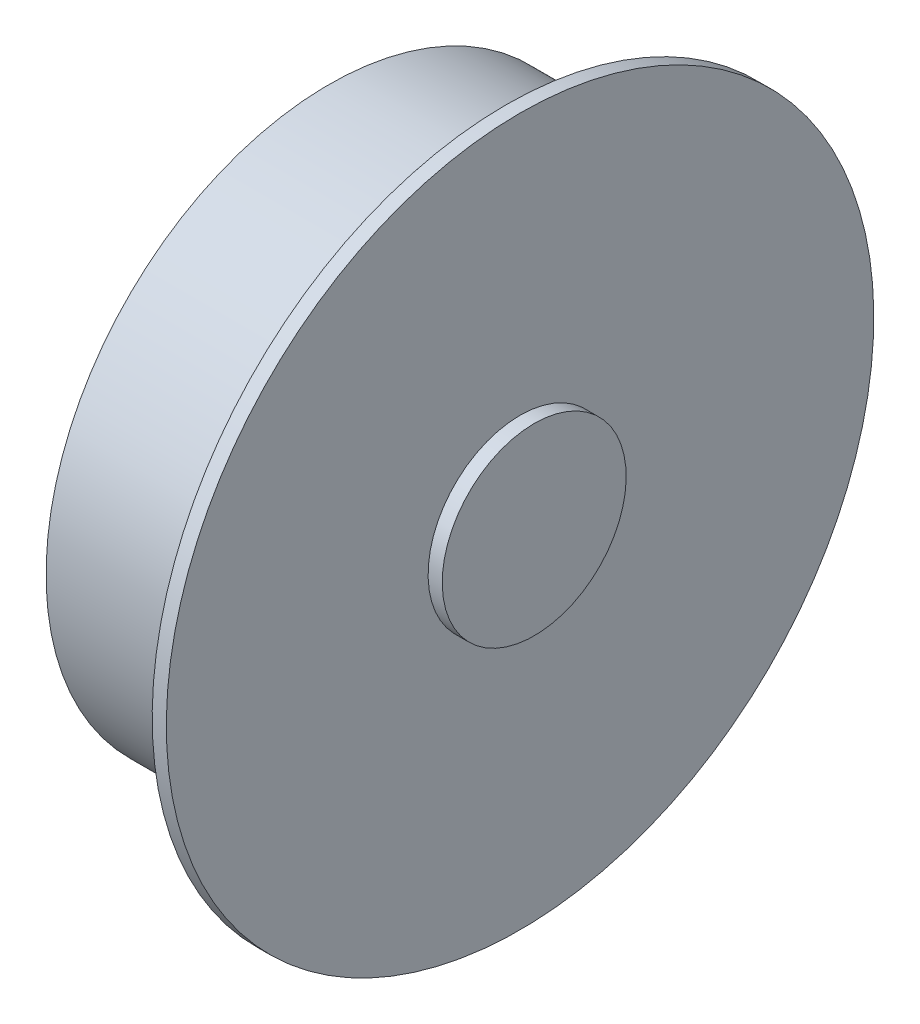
SolidWorks part; units mm, degrees
ref_plane "Alzado" through (0, 0, 0) normal (0, 0, 1) x (1, 0, 0)
ref_plane "Planta" through (0, 0, 0) normal (0, 1, 0) x (1, 0, 0)
ref_plane "Vista lateral" through (0, 0, 0) normal (1, 0, 0) x (0, 0, -1)
sketch "Croquis1" plane through (0, 0, 0) normal (0, 0, 1) x (1, 0, 0)
  line L0 (0, 0) -> (60, 0)
  line L2 (60, 0) -> (60, 80)
  dimension "D1" = 60
  dimension "D3" = 80
sketch "Croquis114" plane through (0, 0, 0) normal (1, 0, 0) x (0, 0, -1)
  circle A0 centre (0, 0) radius 40
  dimension "D1" = 80
extrude "Saliente-Extruir1" add sketch "Croquis114" against normal blind 25
fillet "Redondeo1" radius 1 1 edges at (0, 0, -40)
sketch "Croquis115" plane through (0, 0, 0) normal (1, 0, 0) x (0, 0, -1)
  circle A0 centre (0, 0) radius 50
extrude "Saliente-Extruir2" add sketch "Croquis115" along normal blind 2
sketch "Croquis122" plane through (2, 0, 0) normal (1, 0, 0) x (0, 0, -1)
  circle A0 centre (0, 0) radius 13
  dimension "D1" = 26
extrude "Saliente-Extruir3" add sketch "Croquis122" along normal blind 2 separate body
